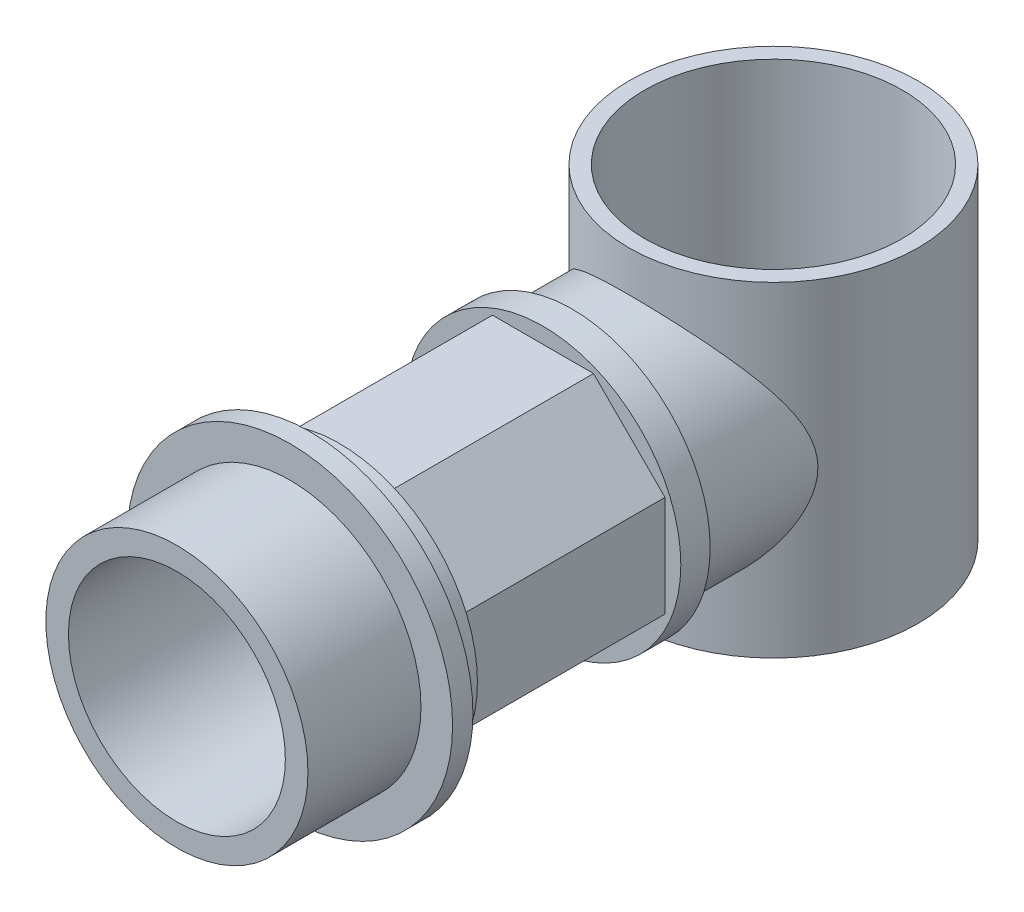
SolidWorks part; units mm, degrees
ref_plane "Ebene vorne" through (0, 0, 0) normal (0, 0, 1) x (1, 0, 0)
ref_plane "Ebene oben" through (0, 0, 0) normal (0, 1, 0) x (1, 0, 0)
ref_plane "Ebene rechts" through (0, 0, 0) normal (1, 0, 0) x (0, 0, -1)
sketch "Skizze1" plane through (0, 0, 0) normal (0, 0, 1) x (1, 0, 0)
  circle A0 centre (0, 0) radius 29
  circle A1 centre (0, 0) radius 24
  dimension "D1" = 58
  dimension "D2" = 48
extrude "Linear austragen1" add sketch "Skizze1" against normal blind 25
sketch "Skizze2" plane through (0, 0, -25) normal (0, 0, -1) x (-1, 0, 0)
  circle A0 centre (0, 0) radius 36
  circle A1 centre (0, 0) radius 24 construction
  circle A2 centre (0, 0) radius 24
  dimension "D1" = 72
extrude "Linear austragen2" add sketch "Skizze2" along normal blind 4.5
sketch "Skizze3" plane through (0, 0, -29.5) normal (0, 0, -1) x (-1, 0, 0)
  circle A0 centre (0, 0) radius 24 construction
  circle A1 centre (0, 0) radius 24
  circle A2 centre (0, 0) radius 30.5
  dimension "D1" = 61
extrude "Linear austragen3" add sketch "Skizze3" along normal blind 6.5
sketch "Skizze4" plane through (0, 0, -36) normal (0, 0, -1) x (-1, 0, 0)
  line L1 (11.1838, -27) -> (27, -11.1838)
  line L2 (27, -11.1838) -> (27, 11.1838)
  line L3 (27, 11.1838) -> (11.1838, 27)
  line L4 (11.1838, 27) -> (-11.1838, 27)
  line L5 (-11.1838, 27) -> (-27, 11.1838)
  line L6 (-27, 11.1838) -> (-27, -11.1838)
  line L7 (-27, -11.1838) -> (-11.1838, -27)
  line L8 (-11.1838, -27) -> (11.1838, -27)
  circle A0 centre (0, 0) radius 27 construction
  circle A1 centre (0, 0) radius 24 construction
  circle A2 centre (0, 0) radius 24
  dimension "D1" = 54
extrude "Linear austragen4" add sketch "Skizze4" along normal blind 45
sketch "Skizze5" plane through (0, 0, -81) normal (0, 0, -1) x (-1, 0, 0)
  circle A0 centre (0, 0) radius 30.5 construction
  circle A1 centre (0, 0) radius 30.5
  circle A2 centre (0, 0) radius 24 construction
  circle A3 centre (0, 0) radius 24
extrude "Linear austragen5" add sketch "Skizze5" along normal blind 6.5
sketch "Skizze6" plane through (0, 0, -87.5) normal (0, 0, -1) x (-1, 0, 0)
  circle A0 centre (0, 0) radius 24 construction
  circle A1 centre (0, 0) radius 24
  circle A2 centre (0, 0) radius 27
  dimension "D1" = 54
extrude "Linear austragen6" add sketch "Skizze6" along normal blind 50
sketch "Skizze7" plane through (0, 0, 0) normal (0, 1, 0) x (1, 0, 0)
  line L0 (-29, 0) -> (29, 0) construction
  line L1 (0, 0) -> (0, 184.6772) construction
  circle A0 centre (0, 132) radius 32
  circle A1 centre (0, 132) radius 28.5
  dimension "D2" = 64
  dimension "D3" = 57
  dimension "D1" = 132
extrude "Linear austragen7" add sketch "Skizze7" along normal blind 36 and the other way blind 36
sketch "Skizze8" plane through (0, 0, 0) normal (0, 1, 0) x (1, 0, 0)
  circle A0 centre (0, 132) radius 28.5 construction
  circle A1 centre (0, 132) radius 28.5
extrude "Schnitt-Linear austragen1" cut sketch "Skizze8" against normal through all and the other way through all
sketch "Skizze9" plane through (0, 0, 0) normal (0, 0, 1) x (1, 0, 0)
  circle A0 centre (0, 0) radius 24 construction
  circle A1 centre (0, 0) radius 24
extrude "Schnitt-Linear austragen2" cut sketch "Skizze9" against normal up to surface (116.6296 mm away)
